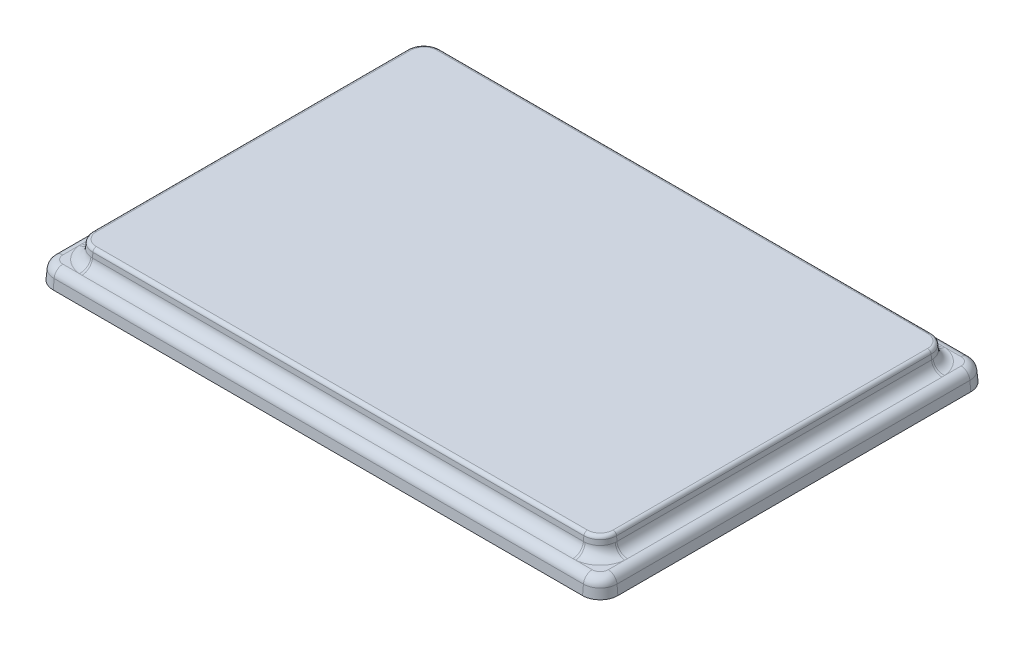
SolidWorks part; units mm, degrees
ref_plane "Front Plane" through (0, 0, 0) normal (0, 0, 1) x (1, 0, 0)
ref_plane "Top Plane" through (0, 0, 0) normal (0, 1, 0) x (1, 0, 0)
ref_plane "Right Plane" through (0, 0, 0) normal (1, 0, 0) x (0, 0, -1)
sketch "Sketch1" plane through (0, 0, 0) normal (0, 1, 0) x (1, 0, 0)
  line L1 (-75, -55) -> (75, -55)
  line L2 (-80, -50) -> (-80, 50)
  line L3 (-75, 55) -> (75, 55)
  line L4 (80, -50) -> (80, 50)
  line L5 (-80, -55) -> (80, 55) construction
  line L6 (-80, 55) -> (80, -55) construction
  arc A0 (75, 55) -> (80, 50) centre (75, 50) cw
  arc A1 (75, -55) -> (80, -50) centre (75, -50) ccw
  arc A2 (-75, -55) -> (-80, -50) centre (-75, -50) cw
  arc A3 (-80, 50) -> (-75, 55) centre (-75, 50) cw
  point P0 (0, 0)
  dimension "D3" = 5
  dimension "D1" = 160
  dimension "D2" = 110
extrude "Boss-Extrude1" add sketch "Sketch1" along normal blind 5 draft 5
sketch "Sketch2" plane through (0, 5, 0) normal (0, 1, 0) x (1, 0, 0)
  line L12 (74.5626, 49.5626) -> (-74.5626, 49.5626)
  line L13 (-74.5626, 49.5626) -> (-74.5626, -49.5626)
  line L14 (-74.5626, -49.5626) -> (74.5626, -49.5626)
  line L15 (74.5626, -49.5626) -> (74.5626, 49.5626)
  line L16 (69.5626, 49.5626) -> (-69.5626, 49.5626)
  line L17 (-74.5626, 44.5626) -> (-74.5626, -44.5626)
  line L18 (-69.5626, -49.5626) -> (69.5626, -49.5626)
  line L19 (74.5626, -44.5626) -> (74.5626, 44.5626)
  arc A8 (69.5626, -49.5626) -> (74.5626, -44.5626) centre (69.5626, -44.5626) ccw
  arc A9 (69.5626, 49.5626) -> (74.5626, 44.5626) centre (69.5626, 44.5626) cw
  arc A10 (-69.5626, 49.5626) -> (-74.5626, 44.5626) centre (-69.5626, 44.5626) ccw
  arc A11 (-74.5626, -44.5626) -> (-69.5626, -49.5626) centre (-69.5626, -44.5626) ccw
  dimension "D2" = 5
  dimension "D1" = 5
extrude "Boss-Extrude2" add sketch "Sketch2" along normal blind 5 draft 5
fillet "Fillet1" radius 2.5 8 edges at (-78.2262, 5, -53.2262) (-79.5626, 5, 0) (-78.2262, 5, 53.2262) (0, 5, 54.5626) (78.2262, 5, 53.2262) (79.5626, 5, 0) (78.2262, 5, -53.2262) (0, 5, -54.5626)
fillet "Fillet2" radius 3 8 edges at (-73.0981, 5, -48.0981) (-74.5626, 5, 0) (-73.0981, 5, 48.0981) (0, 5, 49.5626) (73.0981, 5, 48.0981) (74.5626, 5, 0) (73.0981, 5, -48.0981) (0, 5, -49.5626)
fillet "Fillet3" radius 1 8 edges at (-72.7888, 10, 47.7888) (0, 10, 49.1251) (72.7888, 10, 47.7888) (74.1251, 10, 0) (72.7888, 10, -47.7888) (0, 10, -49.1251) (-72.7888, 10, -47.7888) (-74.1251, 10, 0)
